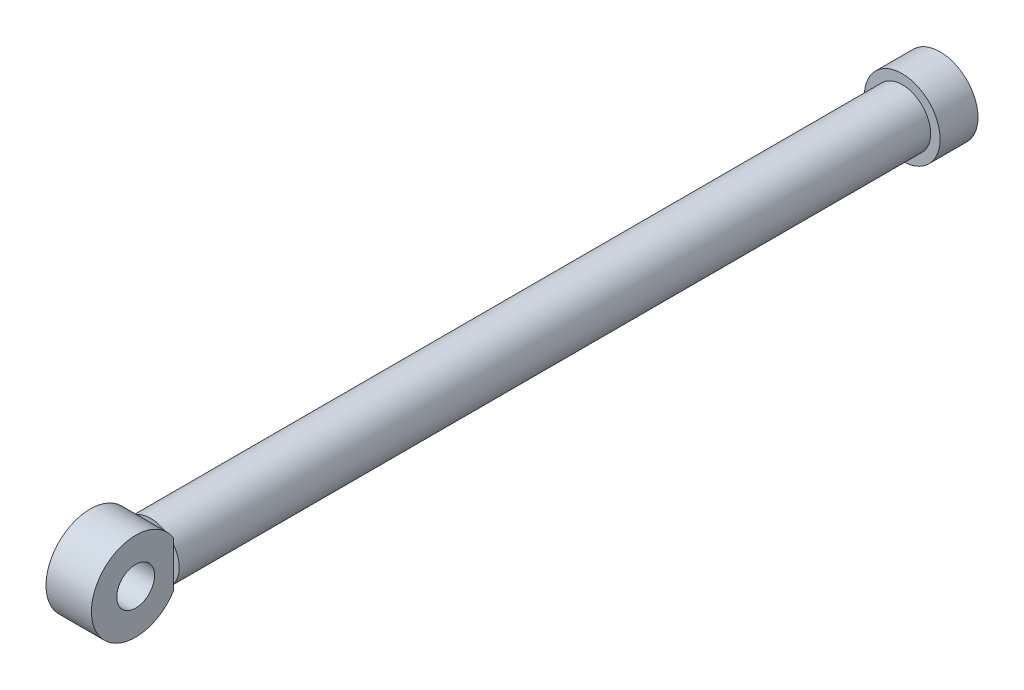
SolidWorks part; units mm, degrees
ref_plane "前视基准面" through (0, 0, 0) normal (0, 0, 1) x (1, 0, 0)
ref_plane "上视基准面" through (0, 0, 0) normal (0, 1, 0) x (1, 0, 0)
ref_plane "右视基准面" through (0, 0, 0) normal (1, 0, 0) x (0, 0, -1)
sketch "草图1" plane through (0, 0, 0) normal (0, 0, 1) x (1, 0, 0)
  circle A0 centre (0, 0) radius 30
  dimension "D1" = 60
extrude "拉伸1" add sketch "草图1" along normal blind 30
sketch "草图2" plane through (0, 0, 30) normal (0, 0, 1) x (1, 0, 0)
  circle A0 centre (0, 0) radius 22.5
  dimension "D1" = 45
extrude "拉伸2" add sketch "草图2" along normal blind 595
sketch "草图4" plane through (0, 0, 0) normal (1, 0, 0) x (0, 0, -1)
  line L0 (-545.0472, 0) -> (-680.3289, 0) construction
  line L4 (-625, 22.5) -> (-625, -22.5) construction
  line L5 (-625, 18.0278) -> (-625, -18.0278)
  arc A0 (-625, 18.0278) -> (-625, -18.0278) centre (-655, 0) ccw
  circle A1 centre (-655, 0) radius 15
  dimension "D2" = 70
  dimension "D1" = 30
  dimension "D3" = 30
extrude "拉伸3" add sketch "草图4" along normal mid plane 36
